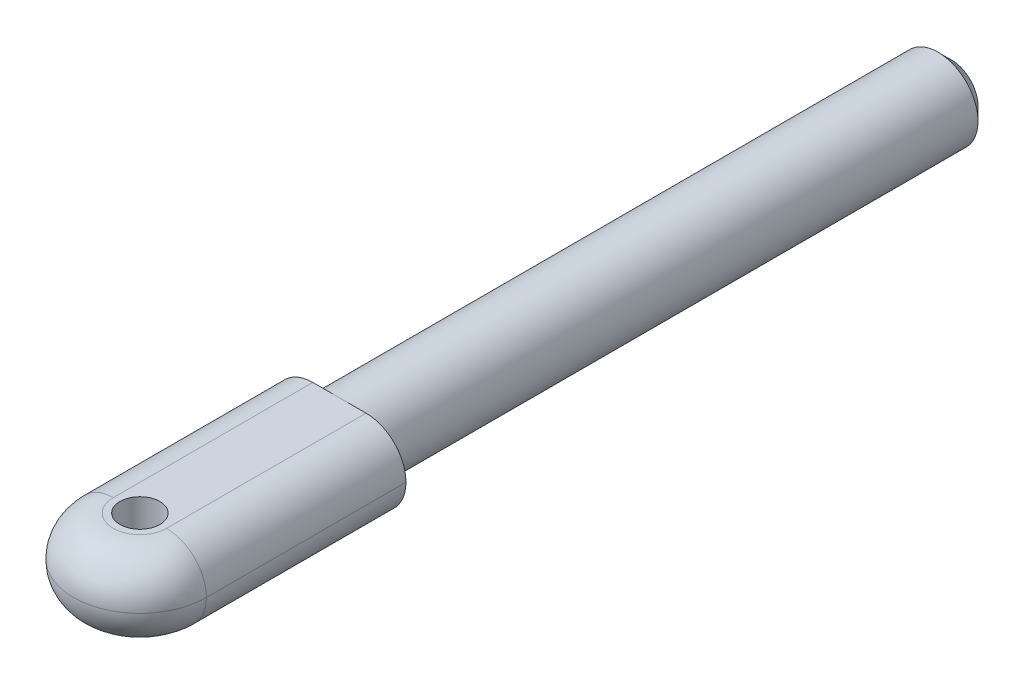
SolidWorks part; units mm, degrees
ref_plane "Plane1" through (0, 0, 0) normal (0, 0, 1) x (1, 0, 0)
ref_plane "Plane2" through (0, 0, 0) normal (0, 1, 0) x (1, 0, 0)
ref_plane "Plane3" through (0, 0, 0) normal (1, 0, 0) x (0, 0, -1)
sketch "Esquisse1" plane through (0, 0, 0) normal (0, 0, 1) x (1, 0, 0)
  circle A0 centre (0, 0) radius 3
  dimension "D1" = 6
extrude "Base-Extrusion" add sketch "Esquisse1" along normal blind 46
ref_plane "Plan6" through (0, 3, 0) normal (0, 1, 0) x (-1, 0, 0)
sketch "Esquisse7" plane through (0, 3, 0) normal (0, 1, 0) x (-1, 0, 0)
  line L0 (0, 46) -> (5, 46)
  line L1 (0, 96) -> (0, -4) construction
  line L2 (5, 46) -> (5, 61)
  line L4 (-5, 61) -> (-5, 46)
  line L5 (-5, 46) -> (0, 46)
  arc A0 (5, 61) -> (-5, 61) centre (0, 61) ccw
  dimension "D2" = 5
  dimension "D3" = 5
extrude "Boss.-Extru.2" add sketch "Esquisse7" against normal blind 6
sketch "Esquisse8" plane through (0, 3, 0) normal (0, 1, 0) x (-1, 0, 0)
  circle A0 centre (0, 61) radius 1.5
  dimension "D1" = 3
extrude "Enlèv. mat.-Extru.5" cut sketch "Esquisse8" against normal blind 6
fillet "Congé7" radius 3
chamfer "Chanfrein1" distance 1 angle 45
